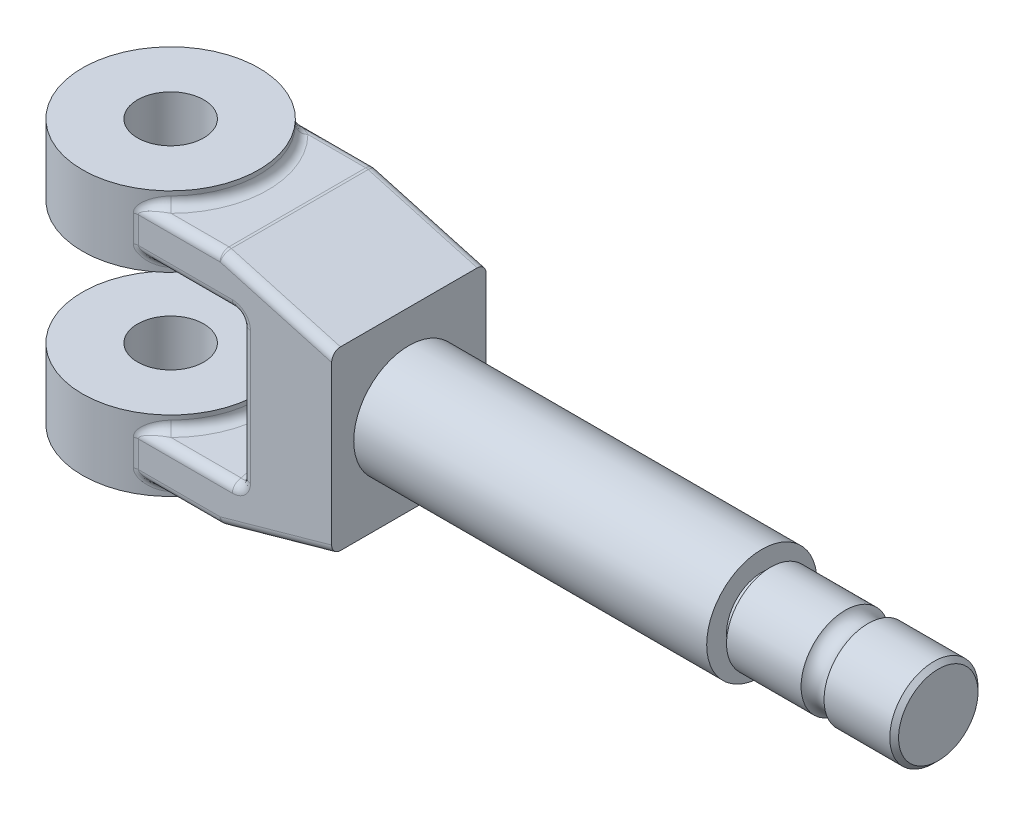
SolidWorks part; units mm, degrees
ref_plane "Plan1" through (0, 0, 0) normal (0, 0, 1) x (1, 0, 0)
ref_plane "Plan2" through (0, 0, 0) normal (0, 1, 0) x (1, 0, 0)
ref_plane "Plan3" through (0, 0, 0) normal (1, 0, 0) x (0, 0, -1)
sketch "Esquisse1" plane through (0, 0, 0) normal (0, 0, 1) x (1, 0, 0)
  line L1 (-54, 27) -> (0, 27)
  line L2 (-54, 27) -> (-54, -27)
  line L3 (-54, -27) -> (0, -27)
  line L4 (0, 27) -> (0, -27)
  dimension "D1" = 54
  dimension "D2" = 54
extrude "Base-Extrusion" add sketch "Esquisse1" along normal mid plane 35
sketch "Esquisse2" plane through (0, 0, 0) normal (0, 1, 0) x (1, 0, 0)
  line L0 (-54, -17.5) -> (-20, -17.5)
  line L1 (-20, -17.5) -> (-24, 0)
  line L2 (-24, 0) -> (-20, 17.5)
  line L3 (-20, 17.5) -> (-54, 17.5)
  line L4 (-54, 17.5) -> (-54, -17.5)
  line L5 (-54, -17.5) -> (-54, 17.5) construction
  line L6 (-54, 17.5) -> (0, 17.5) construction
  line L7 (-50, 0) -> (50, 0) construction
  dimension "D1" = 34
  dimension "D2" = 4
extrude "Enlèv. mat.-Extru.1" cut sketch "Esquisse2" against normal mid plane 34
chamfer "Chanfrein1" distance 7 distance2 25
sketch "Esquisse3" plane through (0, 0, 0) normal (0, 1, 0) x (1, 0, 0)
  line L0 (-54, -17.5) -> (-54, 17.5) construction
  circle A0 centre (-54, 0) radius 20
  dimension "D1" = 40
extrude "Boss.-Extru.1" add sketch "Esquisse3" along normal mid plane 60
sketch "Esquisse4" plane through (0, 0, 0) normal (0, 1, 0) x (1, 0, 0)
  circle A0 centre (-54, 0) radius 20
  circle A1 centre (-54, 0) radius 20 construction
extrude "Enlèv. mat.-Extru.2" cut sketch "Esquisse4" against normal mid plane 28
sketch "Esquisse5" plane through (0, -30, 0) normal (0, -1, 0) x (1, 0, 0)
  circle A0 centre (-54, 0) radius 7.5
  circle A1 centre (-54, 0) radius 20 construction
  dimension "D1" = 15
extrude "Enlèv. mat.-Extru.3" cut sketch "Esquisse5" against normal through all
fillet "Congé1" radius 2
sketch "Esquisse6" plane through (0, 0, 0) normal (1, 0, 0) x (0, 0, -1)
  circle A0 centre (0, 0) radius 12.5
  dimension "D1" = 25
extrude "Boss.-Extru.2" add sketch "Esquisse6" along normal blind 80
sketch "Esquisse7" plane through (80, 0, 0) normal (1, 0, 0) x (0, 0, -1)
  circle A0 centre (0, 0) radius 10
  dimension "D1" = 20
extrude "Boss.-Extru.3" add sketch "Esquisse7" along normal blind 40
sketch "Esquisse8" plane through (0, 0, 0) normal (0, 0, 1) x (1, 0, 0)
  line L0 (80, -12.5) -> (80, 12.5) construction
  line L1 (80, 10) -> (82, 10)
  line L2 (80, 10) -> (80, 8)
  line L3 (80, 8) -> (82, 8)
  line L4 (82, 10) -> (82, 8)
  line L5 (120, 10) -> (80, 10) construction
  line L6 (120, 0) -> (80, 0) construction
  line L7 (120, 0) -> (80, 0) construction
  dimension "D1" = 2
  dimension "D2" = 2
revolve "Enlèvement de matière-Révolution1" cut sketch "Esquisse8" angle 360 about L6
chamfer "Chanfrein2" distance 1 angle 45
sketch "Esquisse9" plane through (0, 0, 0) normal (0, 0, 1) x (1, 0, 0)
  line L0 (80, -12.5) -> (80, 12.5) construction
  line L1 (119, 0) -> (80, 0) construction
  line L2 (119, 0) -> (82, 0) construction
  line L3 (80, 0) -> (0, 0) construction
  circle A0 centre (101.5, 11.5) radius 3
  dimension "D3" = 6
  dimension "D1" = 21.5
  dimension "D2" = 11.5
revolve "Enlèvement de matière-Révolution2" cut sketch "Esquisse9" angle 360 about L1
